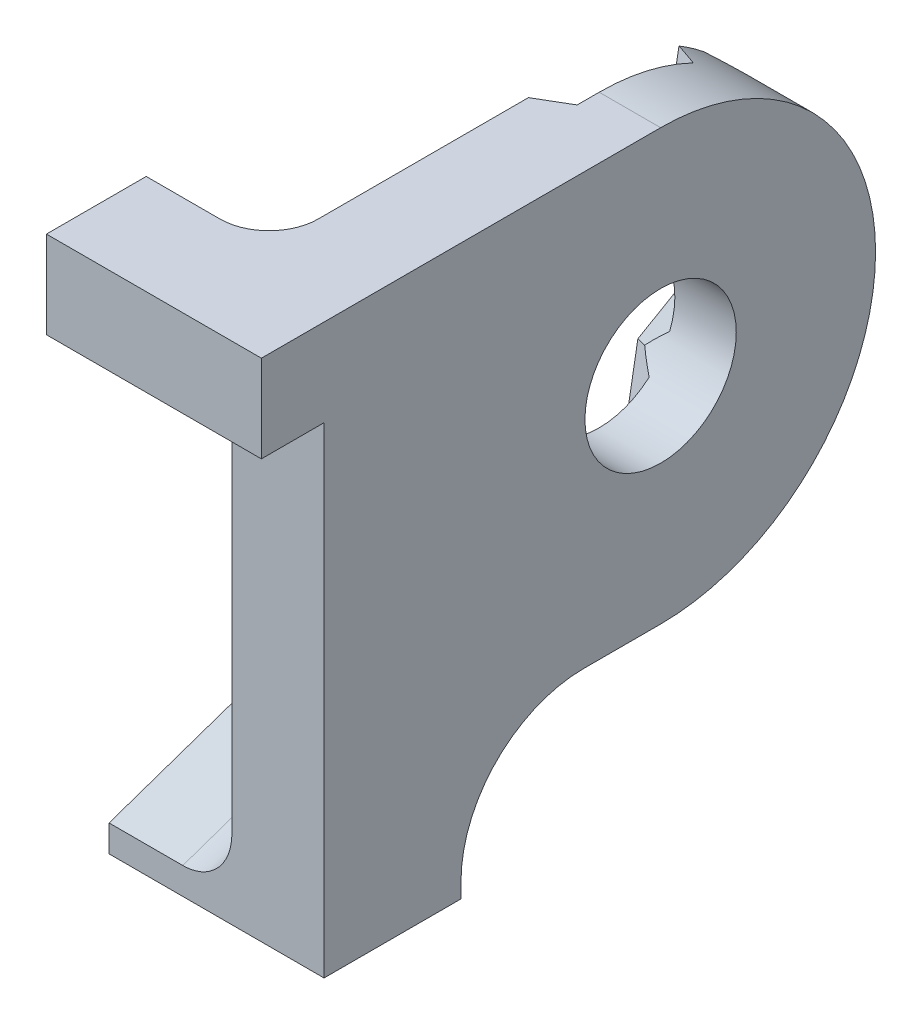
SolidWorks part; units mm, degrees
ref_plane "Спереди" through (0, 0, 0) normal (0, 0, 1) x (1, 0, 0)
ref_plane "Сверху" through (0, 0, 0) normal (0, 1, 0) x (1, 0, 0)
ref_plane "Справа" through (0, 0, 0) normal (1, 0, 0) x (0, 0, -1)
sketch "Эскиз1" plane through (0, 0, 0) normal (1, 0, 0) x (0, 0, -1)
  line L0 (0, 11.1125) -> (-20.6375, 11.1125)
  line L1 (-20.6375, 11.1125) -> (-20.6375, 6.604)
  line L2 (-20.6375, 6.604) -> (-17.399, 6.604)
  line L3 (-17.399, 6.604) -> (-17.399, -18.2563)
  line L4 (-17.399, -18.2563) -> (-10.3187, -18.2563)
  line L5 (0, -11.1125) -> (-3.9687, -11.1125)
  line L6 (-10.3187, -18.2563) -> (-10.3187, -17.4625)
  circle A0 centre (0, 0) radius 3.9116
  arc A1 (0, 11.1125) -> (0, -11.1125) centre (0, 0) cw
  arc A2 (-10.3187, -17.4625) -> (-3.9687, -11.1125) centre (-3.9687, -17.4625) cw
  point P12 (11.1125, 0)
  dimension "D2" = 7.8232
  dimension "D3" = 6.35
  dimension "D1" = 11.1125
  dimension "D4" = 29.3687
  dimension "D5" = 17.399
  dimension "D6" = 31.75
  dimension "D7" = 10.3187
  dimension "D8" = 6.604
extrude "Бобышка-Вытянуть1" add sketch "Эскиз1" along normal blind 4.7625
sketch "Эскиз2" plane through (4.7625, 0, 0) normal (1, 0, 0) x (0, 0, -1)
  line L0 (-17.399, -18.2563) -> (-10.3187, -18.2563)
  line L1 (-20.6375, 11.1125) -> (-15.4781, 11.1125)
  line L2 (-20.6375, 11.1125) -> (-20.6375, 6.604)
  line L3 (-20.6375, 6.604) -> (-15.4781, 6.604)
  line L4 (-15.4781, 11.1125) -> (-15.4781, 6.604)
  line L5 (-10.3187, -18.2563) -> (-10.3187, -17.4625) construction
  line L6 (-17.399, -18.2563) -> (-10.3187, -18.2563) construction
  line L7 (-10.3187, -18.2563) -> (-10.3187, -14.4328)
  line L8 (-10.3187, -14.4328) -> (-17.399, -16.8707)
  line L9 (-17.399, 6.604) -> (-17.399, -18.2563) construction
  line L10 (-17.399, -16.8707) -> (-17.399, -18.2563)
  line L11 (-20.6375, 6.604) -> (-17.399, 6.604) construction
  dimension "D1" = 19
  dimension "D2" = 10.287
  dimension "D3" = 15.4781
extrude "Бобышка-Вытянуть2" add sketch "Эскиз2" against normal blind 11.1125
fillet "Скругление1" radius 2.54 2 edges at (0, -15.6517, 13.8589) (0, 8.8582, 15.4781)
sketch "Эскиз3" plane through (0, 0, 0) normal (-1, 0, 0) x (0, 0, 1)
  line L0 (0, 0) -> (-3.0089, 17.0643) construction
  line L1 (0, 0) -> (-19.4997, 11.2581) construction
  line L2 (0, 11.1125) -> (20.6375, 11.1125) construction
  line L3 (17.399, 6.604) -> (17.399, -18.2563) construction
  line L4 (2.0705, 11.1125) -> (3.5871, 2.5117)
  line L5 (-5.9894, 11.1125) -> (-5.3864, 7.6925)
  line L6 (-7.6393, 8.9933) -> (-5.3864, 7.6925)
  line L7 (8.3267, -9.3902) -> (5.3864, -7.6925)
  line L8 (12.2955, -2.5161) -> (8.3267, -9.3902)
  line L9 (2.0705, 11.1125) -> (-5.9894, 11.1125)
  line L10 (-7.6393, 8.9933) -> (-11.6081, 2.1192)
  line L11 (-1.7656, -12.8421) -> (6.0513, -11.4637)
  line L12 (3.5871, 2.5117) -> (12.2955, -2.5161)
  line L13 (5.3864, -7.6925) -> (6.0513, -11.4637)
  line L14 (-3.5871, -2.5117) -> (-11.6081, 2.1192)
  line L15 (-3.5871, -2.5117) -> (-1.7656, -12.8421)
  arc A0 (0, 11.1125) -> (0, -11.1125) centre (0, 0) ccw construction
  arc A1 (10.3187, -17.4625) -> (3.9687, -11.1125) centre (3.9687, -17.4625) ccw construction
  dimension "D1" = 30
  dimension "D2" = 10
  dimension "D3" = 7.9375
  dimension "D4" = 7.9375
  dimension "D5" = 11.9062
extrude "Вырез-Вытянуть1" cut sketch "Эскиз3" against normal blind 1.5875 contours L12 L8 L7 L13 L11 L15 L14 L10 L6 L5 L9 L4
sketch "Эскиз4" plane through (0, -3.437, -1.9844) normal (0, 0.866, 0.5) x (1, 0, 0)
  line L0 (0, -17.1714) -> (0, -11.9062)
  line L1 (0, -11.9062) -> (1.5875, -11.9062)
  line L2 (1.5875, -11.9062) -> (1.5875, -8.511) construction
  line L3 (1.5875, -11.9062) -> (0, -11.9062) construction
  arc A0 (1.5875, -11.9062) -> (0, -17.1714) centre (-7.9375, -11.9062) cw
  dimension "D1" = 9.525
extrude "Вырез-Вытянуть2" cut sketch "Эскиз4" along normal up to surface (7.9375 mm away)
chamfer "Фаска1" distance 1.5875 angle 30 10 edges at (1.5875, 8.6127, -5.5486) (1.5875, 8.1597, -6.1955) (1.182, -3.8909, 14.6767) (1.5875, 6.8121, 2.8288) (1.5875, -0.0022, 7.9413) (1.5875, -6.7114, -2.8466) (1.5875, -0.3795, -7.2802) (1.182, -10.765, 10.708) (1.5875, -9.5781, 5.7189) (1.5875, -8.5414, 6.8566)
